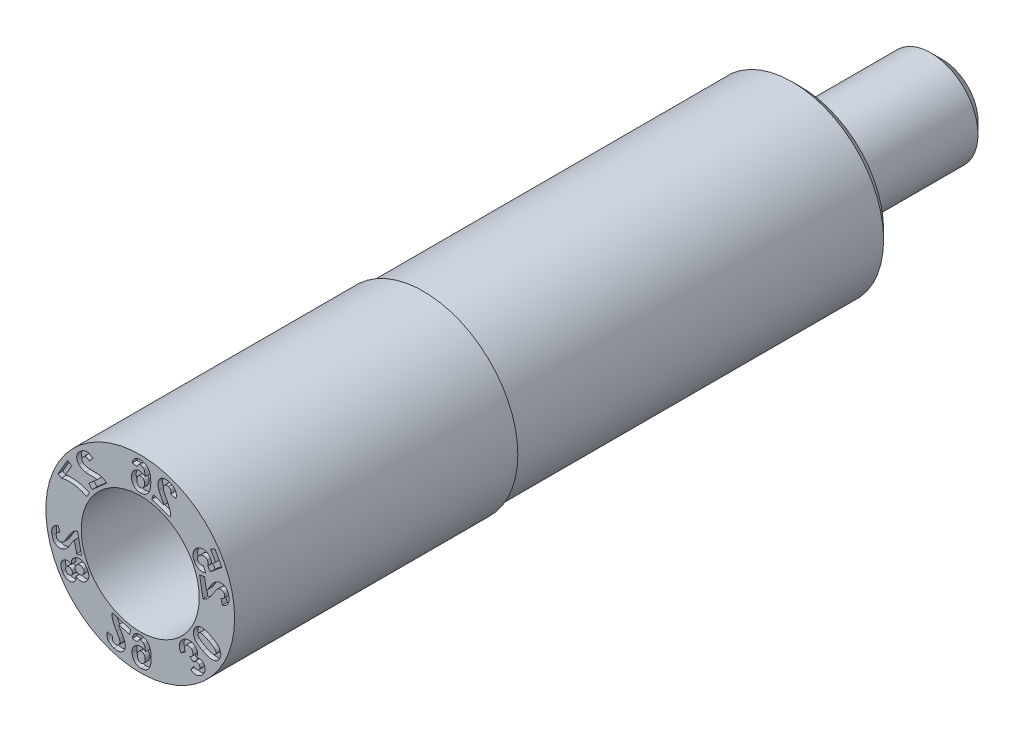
SolidWorks part; units mm, degrees
other "<M2 X .4 SHSS>-<Revolve1>"
ref_plane "Front Plane" through (0, 0, 0) normal (0, 0, 1) x (1, 0, 0)
ref_plane "Top Plane" through (0, 0, 0) normal (0, 1, 0) x (1, 0, 0)
ref_plane "Right Plane" through (0, 0, 0) normal (1, 0, 0) x (0, 0, -1)
sketch "Sketch1" plane through (0, 0, 0) normal (1, 0, 0) x (0, 0, -1)
  line L2 (0, 2) -> (0, 1.25)
  line L3 (13.75, 2) -> (0, 2)
  line L4 (-3.7979, 0) -> (49996.2021, 0) construction
  line L8 (11, 0.7) -> (2.3, 0.7)
  line L9 (2.3, 1.25) -> (2.3, 0.7)
  line L10 (2.3, 1.25) -> (0, 1.25)
  line L12 (14, 1) -> (14, 1.75)
  line L16 (14, 1.75) -> (13.75, 2)
  line L17 (14, 1) -> (11, 1)
  line L18 (11, 0.7) -> (11, 1)
  dimension "D1" = 14
  dimension "D2" = 45
  dimension "D3" = 0.25
  dimension "D4" = 4
  dimension "D5" = 2.5
  dimension "D6" = 2.3
  dimension "D7" = 1.4
  dimension "D8" = 2
  dimension "D9" = 3
revolve "Revolve1" add sketch "Sketch1" angle 360 about L4
sketch "Sketch5" plane through (0, 0, 0) normal (1, 0, 0) x (0, 0, -1)
  line L0 (0, 0) -> (50000, 0) construction
  line L1 (0, 2) -> (0, -2) construction
  line L2 (6, 1.935) -> (14, 1.935)
  line L3 (6, 1.935) -> (6, 2.935)
  line L4 (6, 2.935) -> (14, 2.935)
  line L5 (14, 1.935) -> (14, 2.935)
  line L6 (14, -1.75) -> (14, 1.75) construction
  line L7 (13.75, 2) -> (0, 2) construction
  dimension "D1" = 6
  dimension "D2" = 0.065
  dimension "D3" = 1
revolve "Cut-Revolve1" cut sketch "Sketch5" angle 360 about L0
sketch "Sketch2" plane through (0, 0, 0) normal (0, 0, 1) x (1, 0, 0)
  line L0 (0, 0) -> (0, 2.3112) construction
  line L1 (0, 0) -> (2.0015, 1.1556) construction
  line L2 (0, 0) -> (2.0015, -1.1556) construction
  line L3 (0, 0) -> (0, -2.3112) construction
  line L4 (0, 0) -> (-2.0015, -1.1556) construction
  line L5 (0, 0) -> (-2.0015, 1.1556) construction
  circle A0 centre (0, 0) radius 1.3343 construction
  text T0 "25   26   27   28   29   30" font "Arial" height 0.6
  point P10 (0, 0)
  point P746 (4, 0.001)
  point P747 (0.0034, 0.0034)
  point P748 (0.0034, 0)
  dimension "D1" = 6
extrude "Cut-Extrude1" cut sketch "Sketch2" against normal blind 0.1
sketch "Sketch3" plane through (0, 0, -2.3) normal (0, 0, 1) x (1, 0, 0)
  line L0 (0, 0) -> (0, 50000) construction
  line L1 (0.4041, 0.7) -> (-0.4041, 0.7)
  line L2 (-0.4041, 0.7) -> (-0.8083, 0)
  line L3 (-0.8083, 0) -> (-0.4041, -0.7)
  line L4 (-0.4041, -0.7) -> (0.4041, -0.7)
  line L5 (0.4041, -0.7) -> (0.8083, 0)
  line L6 (0.8083, 0) -> (0.4041, 0.7)
  line L7 (0, 0) -> (50000, 0) construction
  circle A0 centre (0, 0) radius 0.7 construction
  circle A1 centre (0, 0) radius 0.7 construction
extrude "Cut-Extrude2" cut sketch "Sketch3" against normal blind 1.4
inserted part "M2 X .4 SHSS"
move or copy body "Body-Move/Copy2" placed by mates yes
